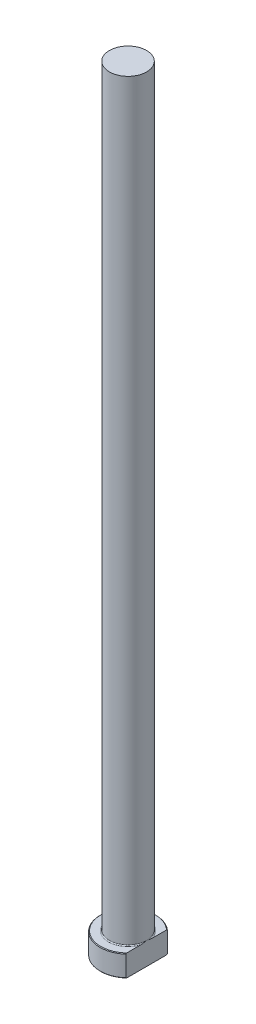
SolidWorks part; units mm, degrees
ref_plane "Front Plane" through (0, 0, 0) normal (0, 0, 1) x (1, 0, 0)
ref_plane "Top Plane" through (0, 0, 0) normal (0, 1, 0) x (1, 0, 0)
ref_plane "Right Plane" through (0, 0, 0) normal (1, 0, 0) x (0, 0, -1)
sketch "Sketch1" plane through (0, 0, 0) normal (0, 0, 1) x (1, 0, 0)
  line L0 (0, 259.9588) -> (0, -15.1925) construction
  line L1 (0, 0) -> (-9, 0)
  line L2 (-9, 0) -> (-9, 7)
  line L3 (-9, 7) -> (-6, 7)
  line L4 (-6, 7) -> (-6, 250)
  line L5 (-6, 250) -> (0, 250)
  line L6 (0, 250) -> (0, 0)
  dimension "L" = 250
  dimension "H" = 18
  dimension "T" = 7
  dimension "D" = 12
revolve "Revolve1" add sketch "Sketch1" angle 360 about L0
chamfer "Chamfer1" distance 0.2 angle 45 2 edges at (0, 7, 9) (0, 0, 9)
fillet "Fillet1" radius 0.3 1 edges at (0, 7, 6)
sketch "Sketch2" plane through (0, 0, 0) normal (0, 1, 0) x (1, 0, 0)
  line L0 (6, 6.7082) -> (6, -6.7082)
  circle A0 centre (0, 0) radius 9 construction
  arc A1 (6, -6.7082) -> (6, 6.7082) centre (0, 0) ccw
  circle A2 centre (0, 0) radius 6 construction
extrude "KEY" cut sketch "Sketch2" along normal through all
